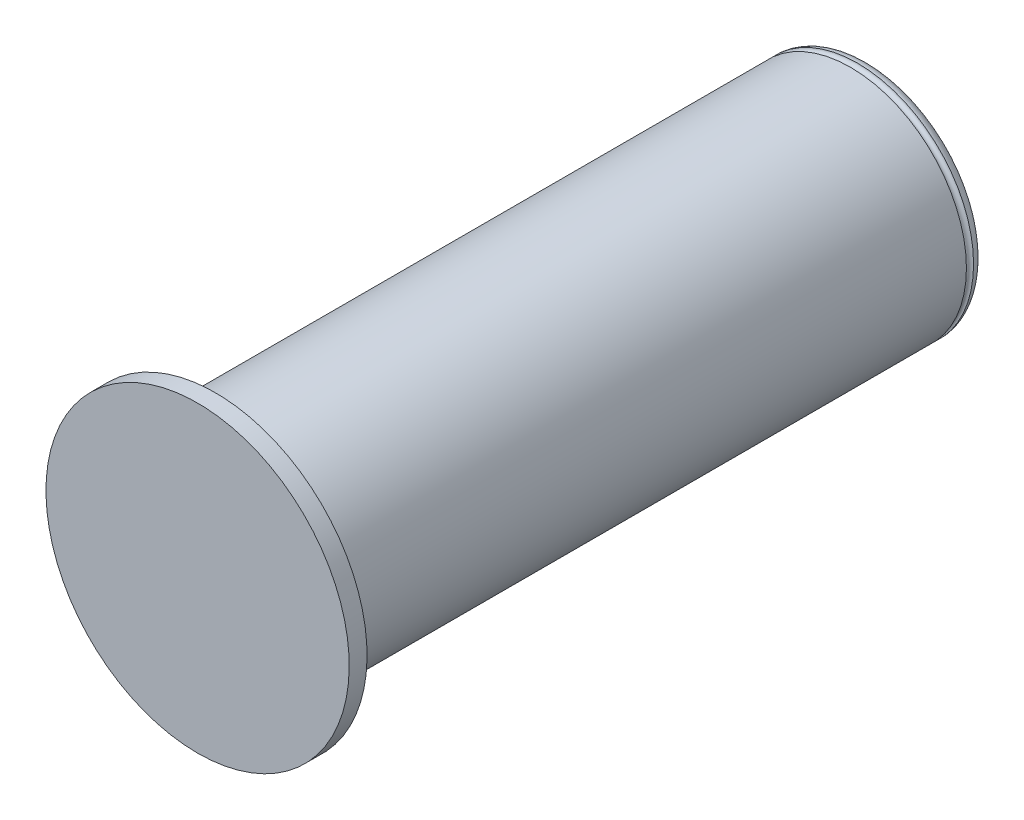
SolidWorks part; units mm, degrees
ref_plane "Front Plane" through (0, 0, 0) normal (0, 0, 1) x (1, 0, 0)
ref_plane "Top Plane" through (0, 0, 0) normal (0, 1, 0) x (1, 0, 0)
ref_plane "Right Plane" through (0, 0, 0) normal (1, 0, 0) x (0, 0, -1)
sketch "Sketch1" plane through (0, 0, 0) normal (1, 0, 0) x (0, 0, -1)
  line L0 (0, 0) -> (54.7136, 0) construction
  line L1 (0, 0) -> (0, 42.5)
  line L2 (0, 42.5) -> (5, 42.5)
  line L3 (5, 42.5) -> (5, 32.5)
  line L4 (5, 32.5) -> (185, 32.5)
  line L5 (188, 29.5) -> (188, 4.5)
  line L6 (187.5, 4) -> (179, 4)
  line L7 (179, 4) -> (176.6906, 0)
  line L8 (188, 4.5) -> (187.5, 4)
  line L9 (0, 0) -> (176.6906, 0)
  arc A0 (185, 32.5) -> (188, 29.5) centre (185, 29.5) cw
  point P13 (188, 32.5)
  dimension "D10" = 3
  dimension "D1" = 45
  dimension "D2" = 0.5
  dimension "D3" = 9
  dimension "D4" = 60
  dimension "D5" = 4
  dimension "D6" = 5
  dimension "D7" = 183
  dimension "D8" = 32.5
  dimension "D9" = 42.5
revolve "Revolve1" add sketch "Sketch1" angle 360 about L0
sketch "Sketch2" plane through (0, 0, 0) normal (1, 0, 0) x (0, 0, -1)
  line L0 (188, 0) -> (184, 0) construction
  line L1 (188, -4.5) -> (188, 4.5) construction
  line L2 (184, 0) -> (184, -32.5) construction
  line L3 (5, -32.5) -> (185, -32.5) construction
  circle A0 centre (184, -32.5) radius 1
  dimension "D2" = 2
  dimension "D1" = 4
revolve "Cut-Revolve1" cut sketch "Sketch2" angle 360 about L0
